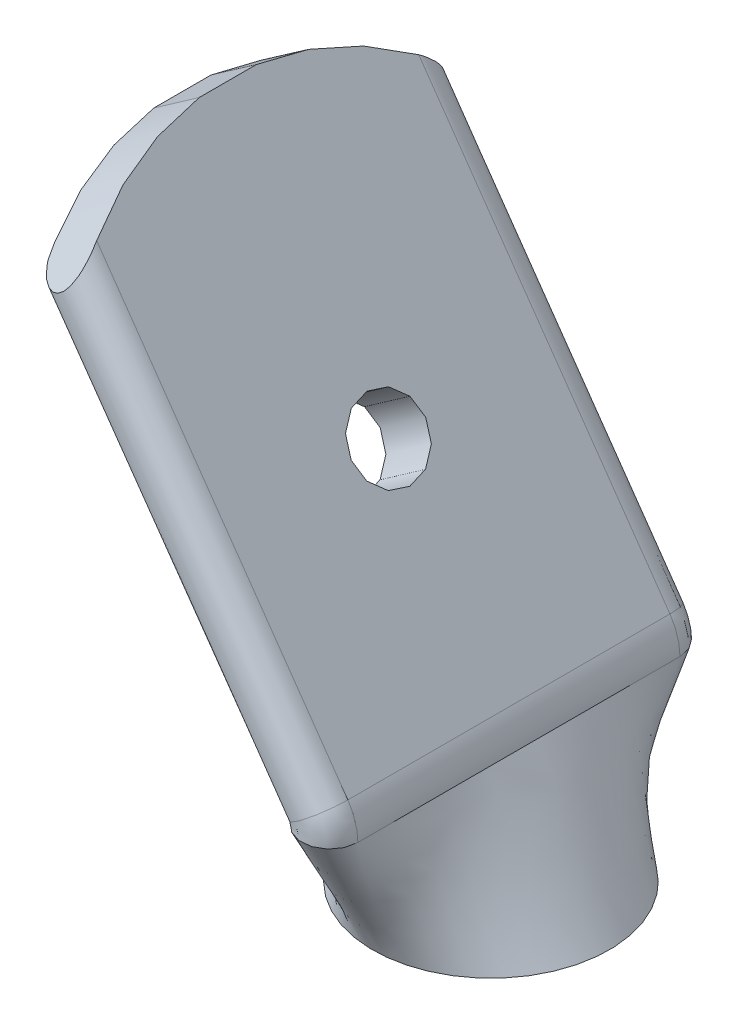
SolidWorks part; units mm, degrees
ref_plane "Front Plane" through (0, 0, 0) normal (0, 0, 1) x (1, 0, 0)
ref_plane "Top Plane" through (0, 0, 0) normal (0, 1, 0) x (1, 0, 0)
ref_plane "Right Plane" through (0, 0, 0) normal (1, 0, 0) x (0, 0, -1)
sketch "Sketch1" plane through (0, 0, 0) normal (0, 1, 0) x (1, 0, 0)
  circle A0 centre (0, 0) radius 10.7315
  dimension "D1" = 21.463
sketch "Sketch3" plane through (0, 0, 0) normal (0, 0, 1) x (1, 0, 0)
  spline S0 degree 3 poles (0, 0) (0, 1.9233) (0, 4.3754) (0, 7.5046) (0, 9.4654) (0, 10.8973) (0, 11.6523) knots 0 0 0 0 0.495171 0.631329 0.805623 1 1 1 1
ref_plane "Plane1" through (0, 11.6523, 0) normal (0, 1, 0) x (0, 0, 1)
sketch "Sketch4" plane through (0, 11.6523, 0) normal (0, 1, 0) x (0, 0, 1)
  line L0 (-14.605, 2.54) -> (14.605, 2.54)
  line L1 (-14.605, -2.54) -> (14.605, -2.54)
  arc A0 (14.605, 2.54) -> (14.605, -2.54) centre (14.605, 0) cw
  arc A1 (-14.605, 2.54) -> (-14.605, -2.54) centre (-14.605, 0) ccw
  dimension "D2" = 29.21
  dimension "D1" = 5.08
  dimension "D3" = 2.54
loft "Loft2" add profiles "Sketch1", "Sketch4"
sketch "Sketch15" plane through (0, 11.6523, 0) normal (0, 1, 0) x (-1, 0, 0)
  line L0 (2.4945, -18.0461) -> (2.4945, 19.3149) construction
revolve "Revolve6" add sketch "Sketch15" angle 35 about L0
sketch "Sketch20" plane through (-6.2955, 8.9908, 0) normal (-0.5736, 0.8192, 0) x (-0.8192, -0.5736, 0)
  line L2 (-4.6401, -15.0851) -> (-4.6401, 15.0849)
  line L3 (-9.6746, 14.605) -> (-9.6746, -14.605)
  line L4 (-4.6401, -15.0851) -> (-4.6401, 15.0849)
  line L5 (-9.6746, 14.605) -> (-9.6746, -14.605)
  spline S2 degree 2 poles (1935.3853, 449.0556) (-27.8984, 32.1118) (-9.5039, -15.5212) (-9.3333, -15.9629) (-9.0142, -16.3141) (-8.6958, -16.6646) (-8.2714, -16.8771) (-7.8481, -17.0891) (-7.3757, -17.1342) (-6.9043, -17.1793) (-6.4474, -17.051) (-5.9916, -16.923) (-5.6117, -16.6386) (-5.2327, -16.3548) (-4.9809, -15.9525) (22.0518, 27.2524) (-1821.7204, 819.4439) knots -13.340277 -13.340277 -13.340277 0.125 0.125 0.25 0.25 0.375 0.375 0.5 0.5 0.625 0.625 0.75 0.75 0.875 0.875 14.329951 14.329951 14.329951 only from (-9.6746, -14.605) to (-4.6401, -15.0851)
  spline S3 degree 2 poles (-1827.0467, -807.7583) (22.0829, -27.3466) (-4.9809, 15.9523) (-5.2319, 16.3538) (-5.6116, 16.6384) (-5.9905, 16.9224) (-6.4473, 17.0509) (-6.9031, 17.1791) (-7.3756, 17.1342) (-7.8469, 17.0893) (-8.2714, 16.877) (-8.6948, 16.6652) (-9.0141, 16.3141) (-9.3327, 15.9638) (-9.5038, 15.5212) (-27.8856, -32.0134) (1932.3616, -461.5367) knots -13.340293 -13.340293 -13.340293 0.125 0.125 0.25 0.25 0.375 0.375 0.5 0.5 0.625 0.625 0.75 0.75 0.875 0.875 14.329966 14.329966 14.329966 only from (-4.6401, 15.0849) to (-9.6746, 14.605)
  spline S4 degree 2 poles (-9.6746, -14.605) (-9.6746, -15.079) (-9.5039, -15.5212) (-9.3333, -15.9629) (-9.0142, -16.3141) (-8.6958, -16.6646) (-8.2714, -16.8771) (-7.8481, -17.0891) (-7.3757, -17.1342) (-6.9043, -17.1793) (-6.4474, -17.051) (-5.9916, -16.923) (-5.6117, -16.6386) (-5.2327, -16.3548) (-4.9809, -15.9525) (-4.7298, -15.5511) (-4.6401, -15.0851) knots 0 0 0 0.125 0.125 0.25 0.25 0.375 0.375 0.5 0.5 0.625 0.625 0.75 0.75 0.875 0.875 1 1 1
  spline S5 degree 2 poles (-4.6401, 15.0849) (-4.7297, 15.5504) (-4.9809, 15.9523) (-5.2319, 16.3538) (-5.6116, 16.6384) (-5.9905, 16.9224) (-6.4473, 17.0509) (-6.9031, 17.1791) (-7.3756, 17.1342) (-7.8469, 17.0893) (-8.2714, 16.877) (-8.6948, 16.6652) (-9.0141, 16.3141) (-9.3327, 15.9638) (-9.5038, 15.5212) (-9.6746, 15.0796) (-9.6746, 14.605) knots 0 0 0 0.125 0.125 0.25 0.25 0.375 0.375 0.5 0.5 0.625 0.625 0.75 0.75 0.875 0.875 1 1 1
  dimension "D1" = 0
extrude "Extrude1" add sketch "Sketch20" along normal blind 44.45
sketch "Sketch21" plane through (3.801, 2.6615, 0) normal (-0.8192, -0.5736, 0) x (0, 0, 1)
  line L0 (-17.2055, 48.4377) -> (-17.2055, 58.0861)
  line L1 (-17.2055, 58.0861) -> (17.2055, 58.0861)
  line L2 (17.2055, 58.0861) -> (17.2055, 48.4377)
  line L3 (-15.0851, 10.9758) -> (15.0849, 10.9758) construction
  arc A0 (-17.2055, 48.4377) -> (17.2055, 48.4377) centre (0, 31.2322) cw
  dimension "D1" = 24.3322
  dimension "D2" = 20.2564
extrude "Cut-Extrude1" cut sketch "Sketch21" against normal through all
sketch "Sketch22" plane through (3.801, 2.6615, 0) normal (-0.8192, -0.5736, 0) x (0, 0, 1)
  line L0 (-2.5933, 55.4258) -> (2.5933, 55.4258) construction
  circle A0 centre (0, 30.0258) radius 3.3782
  point P2 (0, 55.4258)
  dimension "D1" = 25.4
extrude "Cut-Extrude2" cut sketch "Sketch22" against normal through all
